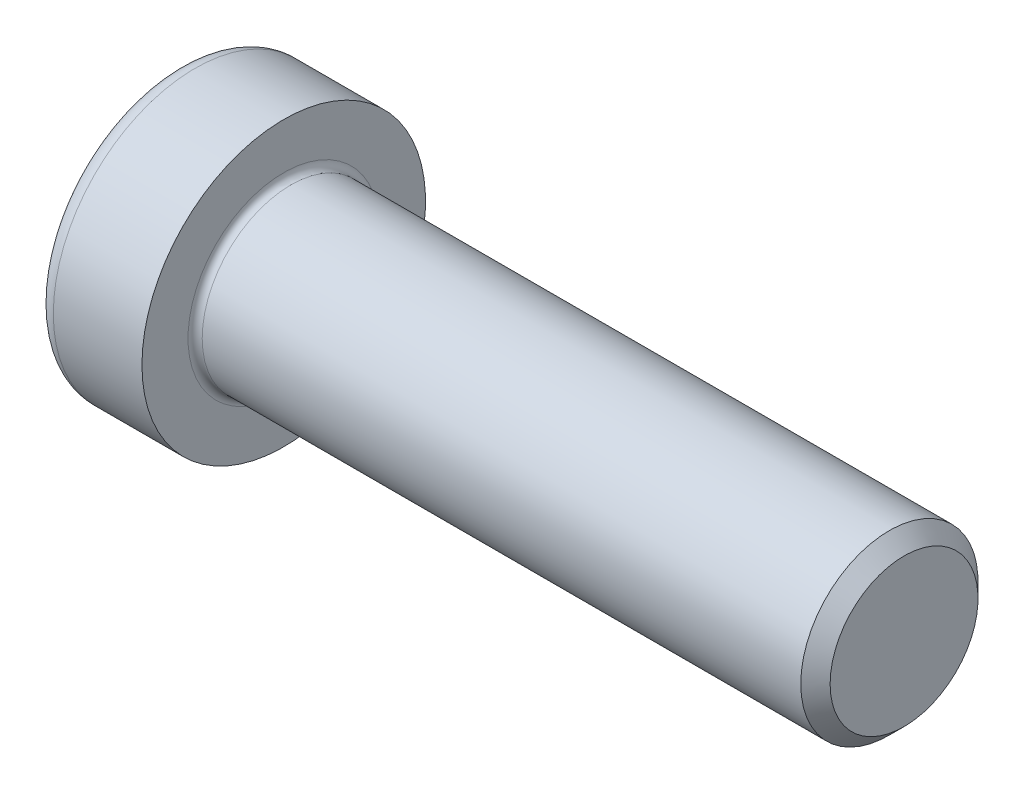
SolidWorks part; units mm, degrees
ref_plane "Plane1" through (0, 0, 0) normal (0, 0, 1) x (1, 0, 0)
ref_plane "Plane2" through (0, 0, 0) normal (0, 1, 0) x (1, 0, 0)
ref_plane "Plane3" through (0, 0, 0) normal (1, 0, 0) x (0, 0, -1)
sketch "BodySke" plane through (0, 0, 0) normal (0, 0, 1) x (1, 0, 0)
  line L0 (0, 0) -> (0, 8)
  line L1 (0, 8) -> (6, 8)
  line L2 (6, 8) -> (6, 5)
  line L3 (6, 5) -> (40.172, 5)
  line L4 (41, 4.172) -> (41, 0)
  line L5 (41, 0) -> (0, 0)
  line L6 (-31.75, 0) -> (127, 0) construction
  line L8 (41, 4.172) -> (40.172, 5)
  line L10 (41, -4.172) -> (40.172, -5) construction
  line L11 (7.5, 4.525) -> (7.5, -1.825) construction
  line L12 (6, 4.525) -> (6, -1.825) construction
  line L13 (-19, 4.525) -> (-19, -1.825) construction
  dimension "Diameter" = 10
  dimension "Head_ht" = 6
  dimension "Length" = 35
  dimension "Body_ch_ang" = 45
  dimension "Head_dia" = 16
  dimension "Minor_dia" = 8.344
  dimension "Advance" = 1.5
  dimension "Thread_nom" = 35
  dimension "Thread_length" = 60
revolve "Base-Revolve" add sketch "BodySke"
fillet "Fillet1" radius 0.4 1 edges at (6, 0, 5)
fillet "Fillet2" radius 1 1 edges at (0, 0, 8)
sketch "Sketch2" plane through (0, 0, 0) normal (0, 0, 1) x (1, 0, 0)
  line L0 (0, 3.5) -> (4.5, 3.5)
  line L1 (4.5, 3.5) -> (6.5207, 0)
  line L2 (-31.75, 0) -> (127, 0) construction
  line L3 (6.5207, 0) -> (0, 0)
  line L4 (0, 0) -> (0, 3.5)
  line L6 (0, 0) -> (47.625, 0) construction
  dimension "D1" = 3.5
  dimension "D2" = 60
  dimension "Depth" = 4.5
revolve "Hex-PreBroach" cut sketch "Sketch2" angle 360 about L6
sketch "Sketch3" plane through (0, 0, 0) normal (-1, 0, 0) x (0, 0.5, 0.866)
  line L0 (2.0207, 3.5) -> (-2.0207, 3.5)
  line L1 (-2.0207, 3.5) -> (-4.0415, 0)
  line L2 (2.0207, 3.5) -> (4.0415, 0)
  line L3 (2.0207, -3.5) -> (4.0415, 0)
  line L4 (2.0207, -3.5) -> (-2.0207, -3.5)
  line L5 (-2.0207, -3.5) -> (-4.0415, 0)
  dimension "D1" = 3.5
  dimension "D2" = 3.5
  dimension "Hex_size" = 7
extrude "Hex" cut sketch "Sketch3" against normal blind 4.5
sketch "ThdSchSke" plane through (0, 0, 0) normal (0, 0, 1) x (1, 0, 0)
  line L0 (10.5, -4.172) -> (9.9202, -5)
  line L1 (10.5, -4.172) -> (11.0798, -5)
  line L2 (11.0798, -5) -> (11.0798, -6.25)
  line L3 (-3.175, 0) -> (5.1513, 0) construction
  line L4 (0, 7) -> (0, -7) construction
  line L5 (11.0798, -6.25) -> (9.9202, -6.25)
  line L6 (9.9202, -6.25) -> (9.9202, -5)
  dimension "Thread_minor" = 8.344
  dimension "Diameter" = 10
  dimension "Start" = 10.5
  dimension "SideAngle" = 55
  dimension "VeeAngle" = 70
  dimension "Overcut" = 12.5
revolve "ThreadSchematic" [suppressed] cut sketch "ThdSchSke" angle 360 about L3
pattern_linear "ThdSchPat" [suppressed]
equation "\"D2@Sketch3\" = \"Hex_size@Sketch3\" / 2"
equation "\"D1@Sketch3\" = \"Hex_size@Sketch3\" / 2"
equation "\"D1@Sketch2\" = \"Hex_size@Sketch3\" / 2"
equation "\"Thread_minor@ThreadCosmetic\"  =  \"Minor_dia@BodySke\""
equation "\"Depth@Sketch2\" =  \"Key_eng@Hex\""
equation "\"Thread_length@ThreadCosmetic\" = ((sgn( (\"Length@BodySke\" - \"Advance@BodySke\" * 3.0) - \"Thread_nom@BodySke\" )-1)*( (\"Length@BodySke\" - \"Advance@BodySke\" * 3.0) - \"Thread_nom@BodySke\" ))/-2+ \"Thread_no"
equation "\"Thread_minor@ThdSchSke\" = \"Minor_dia@BodySke\""
equation "\"Diameter@ThdSchSke\" = \"Diameter@BodySke\""
equation "\"Overcut@ThdSchSke\" = \"Diameter@BodySke\" * 1.25"
equation "\"Start@ThdSchSke\" = \"Head_ht@BodySke\" + \"Length@BodySke\" - \"Thread_length@ThreadCosmetic\"  '---Non-countersunk---"
equation "\"Num_threads@ThdSchPat\" = int( \"Thread_length@ThreadCosmetic\" / \"Advance@BodySke\" + 0.999 )  + 1"
equation "\"Advance@ThdSchPat\" = \"Thread_length@ThreadCosmetic\" /  (\"Num_threads@ThdSchPat\" - 1) 'relax it"
equation "\"Num_threads@ThdSchPat\" = \"Num_threads@ThdSchPat\" - sgn( \"Num_threads@ThdSchPat\" - 1) '---chamfered tips only---"
